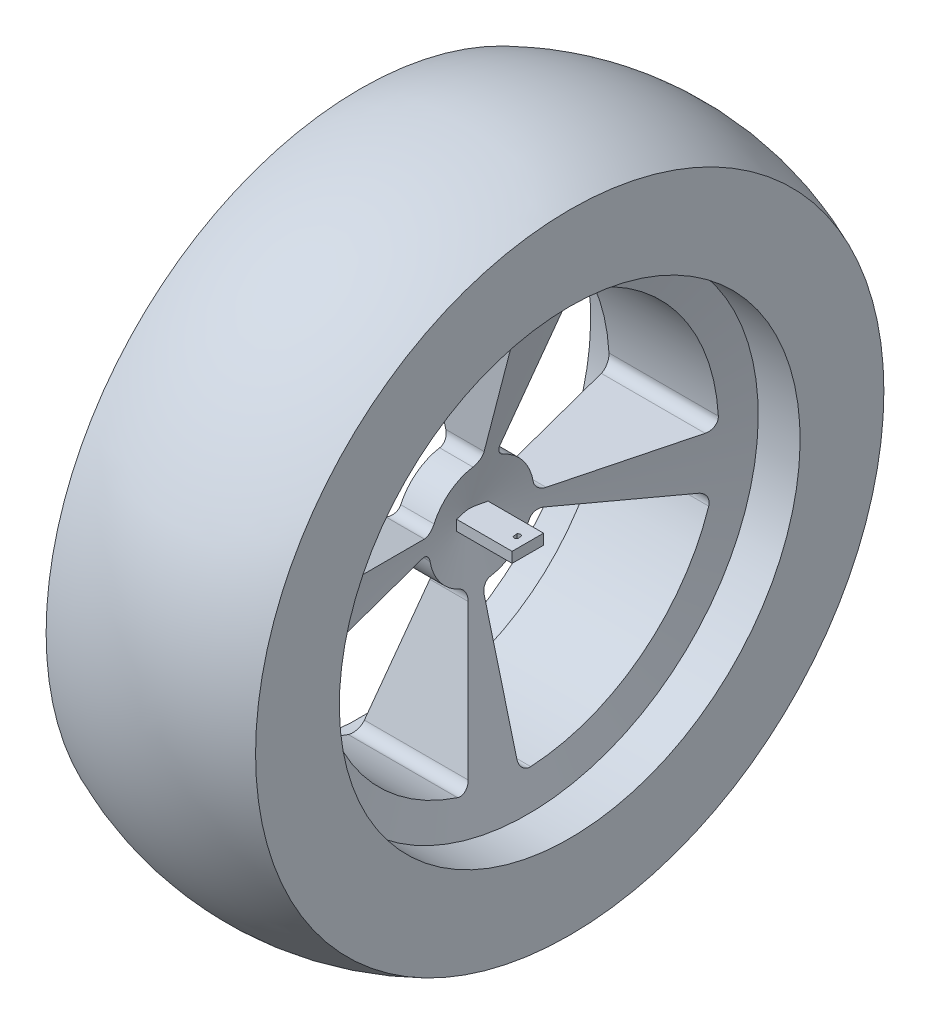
SolidWorks part; units mm, degrees
ref_plane "Plan1" through (0, 0, 0) normal (0, 0, 1) x (1, 0, 0)
ref_plane "Plan2" through (0, 0, 0) normal (0, 1, 0) x (1, 0, 0)
ref_plane "Plan3" through (0, 0, 0) normal (1, 0, 0) x (0, 0, -1)
sketch "Esquisse1" plane through (0, 0, 0) normal (0, 0, 1) x (1, 0, 0)
  line L0 (76.6585, 0) -> (-70.8839, 0) construction
  line L1 (0, 180.3392) -> (0, -322.0816) construction
  line L2 (-2.9236, 0) -> (2.9236, 0)
  line L3 (60, -220) -> (100, -220)
  line L4 (-2.9236, 0) -> (-60, -220)
  line L5 (100, -220) -> (100, -300)
  line L6 (-100, -220) -> (-100, -300)
  line L7 (2.9236, 0) -> (60, -220)
  line L8 (-60, -220) -> (-100, -220)
  arc A0 (100, -300) -> (-100, -300) centre (0, -70.8712) cw
  point P13 (0, 0)
  dimension "D3" = 250
  dimension "D1" = 220
  dimension "D2" = 80
  dimension "D4" = 100
  dimension "D5" = 75.456
  dimension "D6" = 220
  dimension "D7" = 60
revolve "Base-Révolution" add sketch "Esquisse1" angle 360 about L0
sketch "Esquisse2" plane through (0, 0, 0) normal (1, 0, 0) x (0, 0, -1)
  line L0 (-179.722, 0) -> (-59.1608, 0)
  line L1 (0, -179.722) -> (0, -59.1608)
  line L2 (-173.5981, 46.5155) -> (-57.1449, 15.3119)
  line L3 (-46.5155, -173.5981) -> (-15.3119, -57.1449)
  line L5 (57.1449, -15.3119) -> (173.5981, -46.5155)
  line L7 (15.3119, 57.1449) -> (46.5155, 173.5981)
  line L8 (0, 59.1608) -> (0, 179.722)
  line L9 (59.1608, 0) -> (179.722, 0)
  arc A0 (-10.5556, 189.7066) -> (-180.5105, 59.2956) centre (0, 0) ccw
  arc A1 (-8.3333, 49.3007) -> (-45.464, 20.8093) centre (0, 0) ccw
  arc A3 (-189.7066, -10.5556) -> (-59.2956, -180.5105) centre (0, 0) ccw
  arc A4 (10.5556, -189.7066) -> (180.5105, -59.2956) centre (0, 0) ccw
  arc A5 (189.7066, 10.5556) -> (59.2956, 180.5105) centre (0, 0) ccw
  arc A6 (49.3007, 8.3333) -> (20.8093, 45.464) centre (0, 0) ccw
  arc A7 (8.3333, -49.3007) -> (45.464, -20.8093) centre (0, 0) ccw
  arc A8 (-49.3007, -8.3333) -> (-20.8093, -45.464) centre (0, 0) ccw
  arc A17 (0, 179.722) -> (-10.5556, 189.7066) centre (-10, 179.722) ccw
  arc A18 (59.2956, 180.5105) -> (46.5155, 173.5981) centre (56.1747, 171.0099) ccw
  arc A19 (189.7066, 10.5556) -> (179.722, 0) centre (179.722, 10) cw
  arc A20 (180.5105, -59.2956) -> (173.5981, -46.5155) centre (171.0099, -56.1747) ccw
  arc A21 (10.5556, -189.7066) -> (0, -179.722) centre (10, -179.722) cw
  arc A22 (-46.5155, -173.5981) -> (-59.2956, -180.5105) centre (-56.1747, -171.0099) cw
  arc A23 (-189.7066, -10.5556) -> (-179.722, 0) centre (-179.722, -10) cw
  arc A24 (-180.5105, 59.2956) -> (-173.5981, 46.5155) centre (-171.0099, 56.1747) ccw
  arc A25 (-8.3333, 49.3007) -> (0, 59.1608) centre (-10, 59.1608) ccw
  arc A26 (-45.464, 20.8093) -> (-57.1449, 15.3119) centre (-54.5568, 24.9712) cw
  arc A27 (-49.3007, -8.3333) -> (-59.1608, 0) centre (-59.1608, -10) ccw
  arc A28 (-15.3119, -57.1449) -> (-20.8093, -45.464) centre (-24.9712, -54.5568) ccw
  arc A29 (8.3333, -49.3007) -> (0, -59.1608) centre (10, -59.1608) ccw
  arc A30 (57.1449, -15.3119) -> (45.464, -20.8093) centre (54.5568, -24.9712) ccw
  arc A31 (49.3007, 8.3333) -> (59.1608, 0) centre (59.1608, 10) ccw
  arc A32 (20.8093, 45.464) -> (15.3119, 57.1449) centre (24.9712, 54.5568) cw
  dimension "D1" = 380
  dimension "D2" = 100
  dimension "D4" = 10
  dimension "D3" = 15
extrude "Enlèv. mat.-Extru.1" cut sketch "Esquisse2" against normal through all and the other way through all
sketch "Esquisse3" plane through (0, 0, 0) normal (1, 0, 0) x (0, 0, -1)
  line L1 (15, -5) -> (-15, -5)
  line L2 (15, -5) -> (15, 5)
  line L3 (15, 5) -> (-15, 5)
  line L4 (-15, -5) -> (-15, 5)
  dimension "D1" = 5
  dimension "D2" = 10
  dimension "D3" = 15
  dimension "D4" = 30
extrude "Boss.-Extru.1" add sketch "Esquisse3" along normal blind 60
sketch "Esquisse4" plane through (0, 5, 0) normal (0, 1, 0) x (-1, 0, 0)
  line L0 (-60, 15) -> (-7.0257, 15) construction
  line L1 (-60, -15) -> (-60, 15) construction
  line L2 (-48.3198, 2.4853) -> (-47.7167, -1.9459)
  line L3 (-52.2833, 1.9459) -> (-51.6802, -2.4853)
  arc A0 (-48.3198, 2.4853) -> (-52.2833, 1.9459) centre (-50, 0) ccw
  arc A1 (-51.6802, -2.4853) -> (-47.7167, -1.9459) centre (-50, 0) ccw
  dimension "D1" = 6
  dimension "D2" = 15
  dimension "D3" = 10
  dimension "D4" = 2
  dimension "D5" = 4
  dimension "D6" = 7.75
extrude "Enlèv. mat.-Extru.2" cut sketch "Esquisse4" against normal up to next
